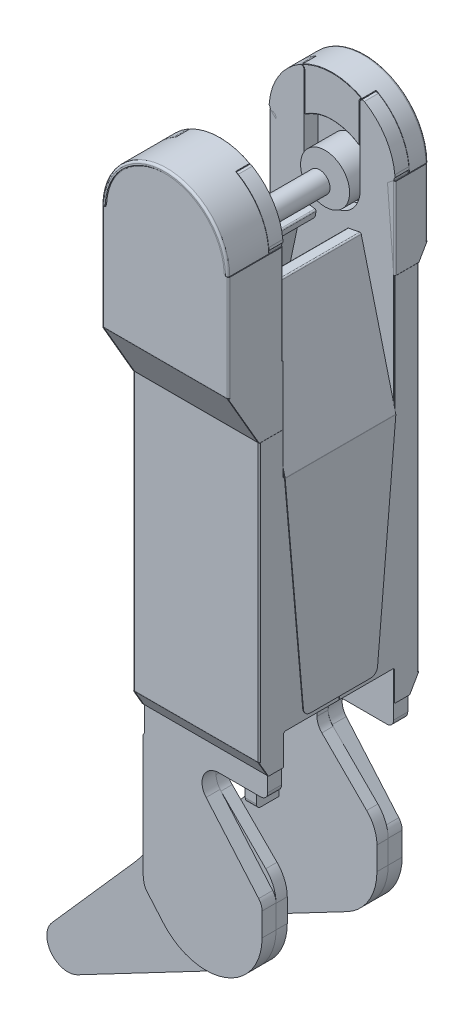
SolidWorks part; units mm, degrees
ref_plane "Ebene vorne" through (0, 0, 0) normal (0, 0, 1) x (1, 0, 0)
ref_plane "Ebene oben" through (0, 0, 0) normal (0, 1, 0) x (1, 0, 0)
ref_plane "Ebene rechts" through (0, 0, 0) normal (1, 0, 0) x (0, 0, -1)
imported_body "Defeature ausgeführt54"
imported_body "Defeature ausgeführt55"
imported_body "Defeature ausgeführt56"
imported_body "Defeature ausgeführt57"
imported_body "Defeature ausgeführt58"
imported_body "Defeature ausgeführt59"
imported_body "Defeature ausgeführt62"
imported_body "Defeature ausgeführt63"
imported_body "Defeature ausgeführt64"
imported_body "Defeature ausgeführt65"
imported_body "Defeature ausgeführt66"
imported_body "Defeature ausgeführt73"
imported_body "Defeature ausgeführt74"
imported_body "Defeature ausgeführt67"
imported_body "Defeature ausgeführt68"
imported_body "Defeature ausgeführt69"
imported_body "Defeature ausgeführt71"
imported_body "Defeature ausgeführt72"
imported_body "Defeature ausgeführt70"
other "Fläche löschen1"
other "Fläche löschen2"
delete or keep bodies "Körper-Löschen/beibehalten 1" [suppressed] type delete bodies bodies 176
other "Fläche löschen3" [suppressed]
delete or keep bodies "Körper-Löschen/beibehalten 2" [suppressed] type keep bodies bodies 160 163
delete or keep bodies "Körper-Löschen/beibehalten 3" [suppressed] type delete bodies bodies 160 163 176
